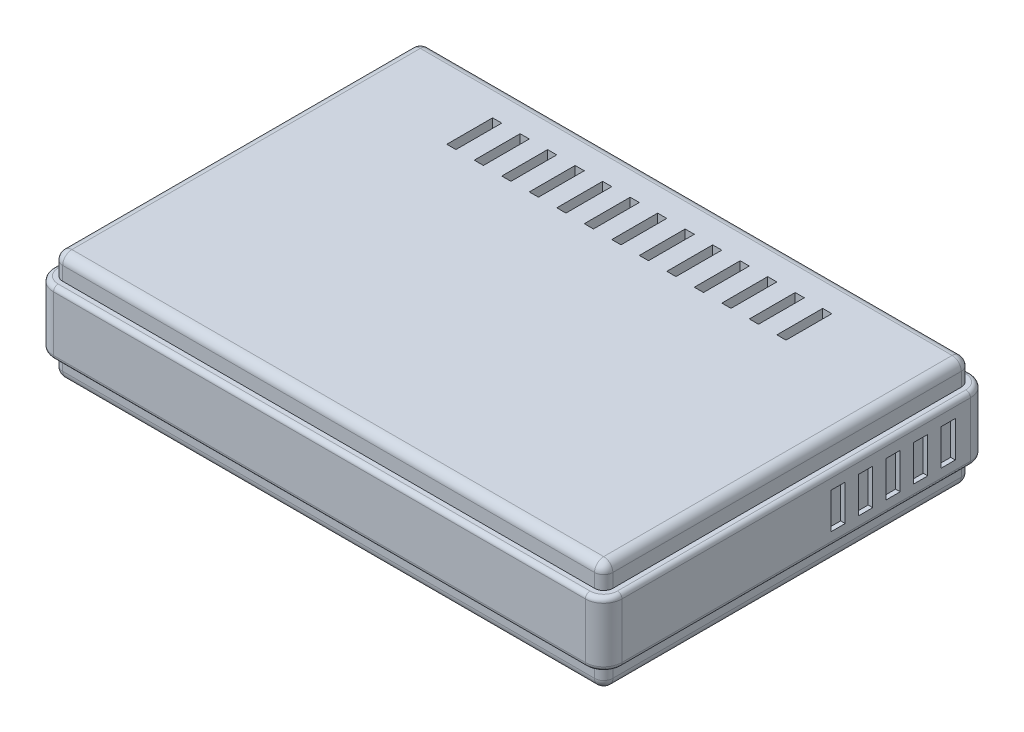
SolidWorks part; units mm, degrees
ref_plane "Front Plane" through (0, 0, 0) normal (0, 0, 1) x (1, 0, 0)
ref_plane "Top Plane" through (0, 0, 0) normal (0, 1, 0) x (1, 0, 0)
ref_plane "Right Plane" through (0, 0, 0) normal (1, 0, 0) x (0, 0, -1)
sketch "Sketch1" plane through (0, 0, 0) normal (0, 1, 0) x (1, 0, 0)
  line L0 (-76.2, -50.8) -> (76.2, 50.8) construction
  line L1 (-76.2, -50.8) -> (76.2, -50.8)
  line L2 (-76.2, -50.8) -> (-76.2, 50.8)
  line L3 (-76.2, 50.8) -> (76.2, 50.8)
  line L4 (76.2, -50.8) -> (76.2, 50.8)
  dimension "D1" = 101.6
  dimension "D2" = 152.4
extrude "Extrude1" add sketch "Sketch1" along normal mid plane 30.48
fillet "Fillet1" radius 2.54 12 edges at (0, -15.24, 50.8) (76.2, -15.24, 0) (0, -15.24, -50.8) (-76.2, -15.24, 0) (0, 15.24, -50.8) (76.2, 15.24, 0) (0, 15.24, 50.8) (-76.2, 15.24, 0) (76.2, 0, 50.8) (76.2, 0, -50.8) (-76.2, 0, -50.8) (-76.2, 0, 50.8)
sketch "Sketch2" plane through (0, 0, 0) normal (0, 1, 0) x (1, 0, 0)
  line L9 (78.74, -48.26) -> (78.74, 48.26)
  line L10 (-73.66, -53.34) -> (73.66, -53.34)
  line L11 (-78.74, 48.26) -> (-78.74, -48.26)
  line L12 (73.66, 53.34) -> (-73.66, 53.34)
  line L13 (78.74, -48.26) -> (78.74, 48.26)
  line L14 (-73.66, -53.34) -> (73.66, -53.34)
  line L15 (-78.74, 48.26) -> (-78.74, -48.26)
  line L16 (73.66, 53.34) -> (-73.66, 53.34)
  arc A8 (78.74, 48.26) -> (73.66, 53.34) centre (73.66, 48.26) ccw
  arc A9 (73.66, -53.34) -> (78.74, -48.26) centre (73.66, -48.26) ccw
  arc A10 (-78.74, -48.26) -> (-73.66, -53.34) centre (-73.66, -48.26) ccw
  arc A11 (-73.66, 53.34) -> (-78.74, 48.26) centre (-73.66, 48.26) ccw
  arc A12 (78.74, 48.26) -> (73.66, 53.34) centre (73.66, 48.26) ccw
  arc A13 (73.66, -53.34) -> (78.74, -48.26) centre (73.66, -48.26) ccw
  arc A14 (-78.74, -48.26) -> (-73.66, -53.34) centre (-73.66, -48.26) ccw
  arc A15 (-73.66, 53.34) -> (-78.74, 48.26) centre (-73.66, 48.26) ccw
  dimension "D1" = 2.54
extrude "Extrude2" add sketch "Sketch2" along normal mid plane 17.78
fillet "Fillet2" radius 1.27 16 edges at (-77.2521, -8.89, -51.8521) (0, -8.89, -53.34) (77.2521, -8.89, -51.8521) (78.74, -8.89, 0) (77.2521, -8.89, 51.8521) (0, -8.89, 53.34) (-77.2521, -8.89, 51.8521) (-77.2521, 8.89, -51.8521) (0, 8.89, -53.34) (77.2521, 8.89, -51.8521) (78.74, 8.89, 0) (77.2521, 8.89, 51.8521) (0, 8.89, 53.34) (-77.2521, 8.89, 51.8521) (-78.74, -8.89, 0) (-78.74, 8.89, 0)
sketch "Sketch3" plane through (78.74, 0, 0) normal (1, 0, 0) x (0, 0, -1)
  line L0 (36.4295, 4.7482) -> (32.5395, 4.7482)
  line L1 (44.0495, 4.7482) -> (40.1595, 4.7482)
  line L2 (44.0495, 4.7482) -> (44.0495, -5.2059)
  line L3 (44.0495, -5.2059) -> (40.1595, -5.2059)
  line L4 (40.1595, 4.7482) -> (40.1595, -5.2059)
  line L5 (36.4295, 4.7482) -> (36.4295, -5.2059)
  line L6 (36.4295, -5.2059) -> (32.5395, -5.2059)
  line L7 (32.5395, 4.7482) -> (32.5395, -5.2059)
  line L8 (28.8095, 4.7482) -> (24.9195, 4.7482)
  line L9 (28.8095, 4.7482) -> (28.8095, -5.2059)
  line L10 (28.8095, -5.2059) -> (24.9195, -5.2059)
  line L11 (24.9195, 4.7482) -> (24.9195, -5.2059)
  line L12 (21.1895, 4.7482) -> (17.2995, 4.7482)
  line L13 (21.1895, 4.7482) -> (21.1895, -5.2059)
  line L14 (21.1895, -5.2059) -> (17.2995, -5.2059)
  line L15 (17.2995, 4.7482) -> (17.2995, -5.2059)
  line L16 (13.5695, 4.7482) -> (9.6795, 4.7482)
  line L17 (13.5695, 4.7482) -> (13.5695, -5.2059)
  line L18 (13.5695, -5.2059) -> (9.6795, -5.2059)
  line L19 (9.6795, 4.7482) -> (9.6795, -5.2059)
extrude "Cut-Extrude1" cut sketch "Sketch3" against normal blind 1.27
mirror "Mirror1" about plane through (0, 0, 0) normal (1, 0, 0) of "Cut-Extrude1"
sketch "Sketch4" plane through (0, 15.24, 0) normal (0, 1, 0) x (1, 0, 0)
  line L0 (0, 0) -> (0, 62.7454) construction
  line L1 (-8.89, 41.6163) -> (-6.35, 41.6163)
  line L2 (-1.27, 41.6163) -> (1.27, 41.6163)
  line L3 (-1.27, 41.6163) -> (-1.27, 28.9163)
  line L4 (-1.27, 28.9163) -> (1.27, 28.9163)
  line L5 (1.27, 41.6163) -> (1.27, 28.9163)
  line L6 (-8.89, 41.6163) -> (-8.89, 28.9163)
  line L7 (-6.35, 41.6163) -> (-6.35, 28.9163)
  line L8 (-8.89, 28.9163) -> (-6.35, 28.9163)
  line L9 (-16.51, 41.6163) -> (-13.97, 41.6163)
  line L10 (-16.51, 41.6163) -> (-16.51, 28.9163)
  line L11 (-13.97, 41.6163) -> (-13.97, 28.9163)
  line L12 (-16.51, 28.9163) -> (-13.97, 28.9163)
  line L13 (-24.13, 41.6163) -> (-21.59, 41.6163)
  line L14 (-24.13, 41.6163) -> (-24.13, 28.9163)
  line L15 (-21.59, 41.6163) -> (-21.59, 28.9163)
  line L16 (-24.13, 28.9163) -> (-21.59, 28.9163)
  line L17 (-31.75, 41.6163) -> (-29.21, 41.6163)
  line L18 (-31.75, 41.6163) -> (-31.75, 28.9163)
  line L19 (-29.21, 41.6163) -> (-29.21, 28.9163)
  line L20 (-31.75, 28.9163) -> (-29.21, 28.9163)
  line L21 (-39.37, 41.6163) -> (-36.83, 41.6163)
  line L22 (-39.37, 41.6163) -> (-39.37, 28.9163)
  line L23 (-36.83, 41.6163) -> (-36.83, 28.9163)
  line L24 (-39.37, 28.9163) -> (-36.83, 28.9163)
  line L25 (-46.99, 41.6163) -> (-44.45, 41.6163)
  line L26 (-46.99, 41.6163) -> (-46.99, 28.9163)
  line L27 (-44.45, 41.6163) -> (-44.45, 28.9163)
  line L28 (-46.99, 28.9163) -> (-44.45, 28.9163)
  line L29 (6.35, 41.6163) -> (8.89, 41.6163)
  line L30 (6.35, 41.6163) -> (6.35, 28.9163)
  line L31 (6.35, 28.9163) -> (8.89, 28.9163)
  line L32 (8.89, 41.6163) -> (8.89, 28.9163)
  line L33 (13.97, 41.6163) -> (16.51, 41.6163)
  line L34 (13.97, 41.6163) -> (13.97, 28.9163)
  line L35 (13.97, 28.9163) -> (16.51, 28.9163)
  line L36 (16.51, 41.6163) -> (16.51, 28.9163)
  line L37 (21.59, 41.6163) -> (24.13, 41.6163)
  line L38 (21.59, 41.6163) -> (21.59, 28.9163)
  line L39 (21.59, 28.9163) -> (24.13, 28.9163)
  line L40 (24.13, 41.6163) -> (24.13, 28.9163)
  line L41 (29.21, 41.6163) -> (31.75, 41.6163)
  line L42 (29.21, 41.6163) -> (29.21, 28.9163)
  line L43 (29.21, 28.9163) -> (31.75, 28.9163)
  line L44 (31.75, 41.6163) -> (31.75, 28.9163)
  line L45 (36.83, 41.6163) -> (39.37, 41.6163)
  line L46 (36.83, 41.6163) -> (36.83, 28.9163)
  line L47 (36.83, 28.9163) -> (39.37, 28.9163)
  line L48 (39.37, 41.6163) -> (39.37, 28.9163)
  line L49 (44.45, 41.6163) -> (46.99, 41.6163)
  line L50 (44.45, 41.6163) -> (44.45, 28.9163)
  line L51 (44.45, 28.9163) -> (46.99, 28.9163)
  line L52 (46.99, 41.6163) -> (46.99, 28.9163)
  dimension "D1" = 2.54
  dimension "D2" = 12.7
extrude "Cut-Extrude2" cut sketch "Sketch4" against normal blind 2.54
sketch "Sketch5" plane through (0, 0, -53.34) normal (0, 0, -1) x (-1, 0, 0)
  line L0 (0, 0) -> (80.9019, 0) construction
  circle A0 centre (-46.109, 0) radius 5.334
  circle A1 centre (12.7236, 0) radius 5.334
  circle A2 centre (43.7444, 0) radius 5.334
  dimension "D1" = 10.668
extrude "Cut-Extrude3" cut sketch "Sketch5" against normal blind 25.4
